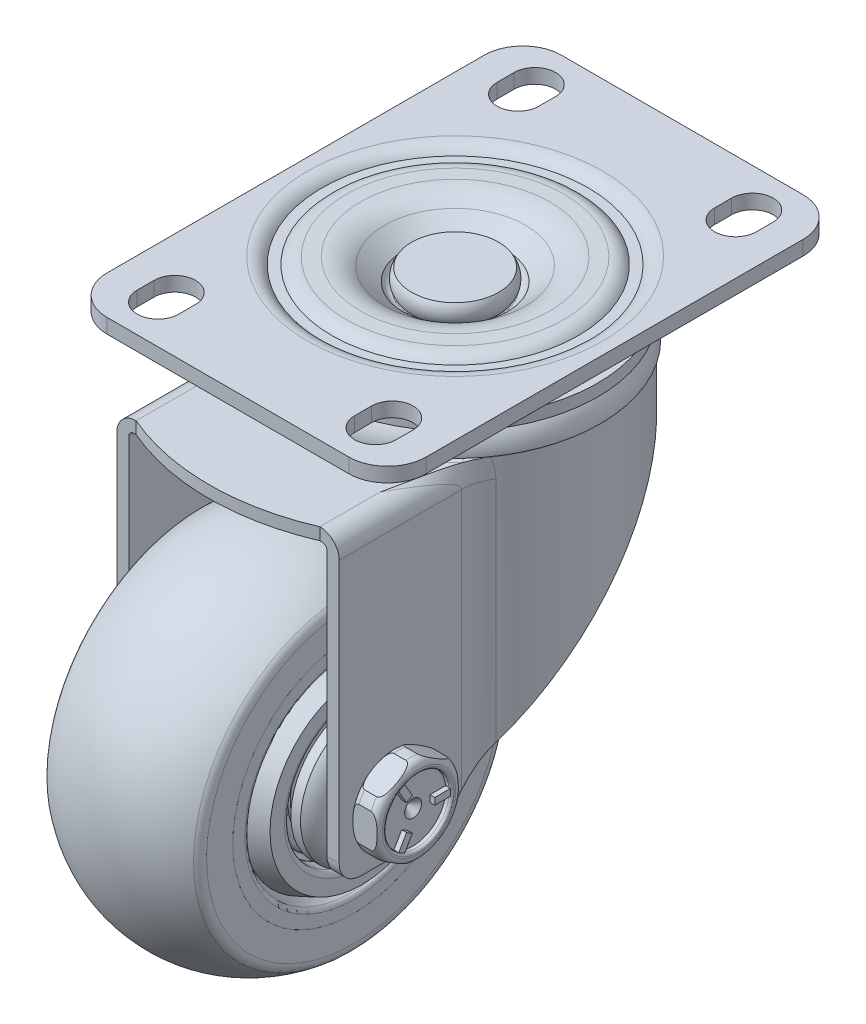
SolidWorks part; units mm, degrees
ref_plane "前视基准面" through (0, 0, 0) normal (0, 0, 1) x (1, 0, 0)
ref_plane "上视基准面" through (0, 0, 0) normal (0, 1, 0) x (1, 0, 0)
ref_plane "右视基准面" through (0, 0, 0) normal (1, 0, 0) x (0, 0, -1)
imported_body "3寸半孤平边外包_默认-1-solid1"
imported_body "轴承6001_默认-1-solid1"
imported_body "轴承6001_默认-1-solid2"
imported_body "轴承6001_默认-1-solid3"
imported_body "轴承6001_默认-1-solid4"
imported_body "轴承6001_默认-1-solid5"
imported_body "轴承6001_默认-1-solid6"
imported_body "轴承6001_默认-1-solid7"
imported_body "轴承6001_默认-1-solid8"
imported_body "轴承6001_默认-1-solid9"
imported_body "轴承6001_默认-1-solid10"
imported_body "M10螺母-1-solid1"
imported_body "3寸双轴内芯_默认-1-solid1"
imported_body "40.2mm中型中管_默认-1-solid1"
imported_body "BF30款6mm钢球_默认-1-solid1"
imported_body "BF30款6mm钢球_默认-1-solid2"
imported_body "BF30款6mm钢球_默认-1-solid3"
imported_body "BF30款6mm钢球_默认-1-solid4"
imported_body "BF30款6mm钢球_默认-1-solid5"
imported_body "BF30款6mm钢球_默认-1-solid6"
imported_body "BF30款6mm钢球_默认-1-solid7"
imported_body "BF30款6mm钢球_默认-1-solid8"
imported_body "BF30款6mm钢球_默认-1-solid9"
imported_body "BF30款6mm钢球_默认-1-solid10"
imported_body "BF30款6mm钢球_默认-1-solid11"
imported_body "BF30款6mm钢球_默认-1-solid12"
imported_body "BF30款6mm钢球_默认-1-solid13"
imported_body "BF30款6mm钢球_默认-1-solid14"
imported_body "BF30款6mm钢球_默认-1-solid15"
imported_body "BF30款6mm钢球_默认-1-solid16"
imported_body "BF30款6mm钢球_默认-1-solid17"
imported_body "BF30款6mm钢球_默认-1-solid18"
imported_body "BF30款6mm钢球_默认-1-solid19"
imported_body "BF30款6mm钢球_默认-1-solid20"
imported_body "BF30款6mm钢球_默认-1-solid21"
imported_body "轴承6001_默认-2-solid1"
imported_body "轴承6001_默认-2-solid2"
imported_body "轴承6001_默认-2-solid3"
imported_body "轴承6001_默认-2-solid4"
imported_body "轴承6001_默认-2-solid5"
imported_body "轴承6001_默认-2-solid6"
imported_body "轴承6001_默认-2-solid7"
imported_body "轴承6001_默认-2-solid8"
imported_body "轴承6001_默认-2-solid9"
imported_body "轴承6001_默认-2-solid10"
imported_body "BF30款小波碗_默认-1-solid1"
imported_body "BF30款12×19平头钉_默认-1-solid1"
imported_body "BF30款大波碗_默认-1-solid1"
imported_body "BF30款底板_默认-1-solid1"
imported_body "双轴盖仔_默认-1-solid1"
imported_body "3寸活动支架_默认-1-solid1"
imported_body "BF30款5mm钢球_默认-1-solid1"
imported_body "BF30款5mm钢球_默认-1-solid2"
imported_body "BF30款5mm钢球_默认-1-solid3"
imported_body "BF30款5mm钢球_默认-1-solid4"
imported_body "BF30款5mm钢球_默认-1-solid5"
imported_body "BF30款5mm钢球_默认-1-solid6"
imported_body "BF30款5mm钢球_默认-1-solid7"
imported_body "BF30款5mm钢球_默认-1-solid8"
imported_body "BF30款5mm钢球_默认-1-solid9"
imported_body "BF30款5mm钢球_默认-1-solid10"
imported_body "BF30款5mm钢球_默认-1-solid11"
imported_body "BF30款5mm钢球_默认-1-solid12"
imported_body "BF30款5mm钢球_默认-1-solid13"
imported_body "BF30款5mm钢球_默认-1-solid14"
imported_body "BF30款5mm钢球_默认-1-solid15"
imported_body "BF30款5mm钢球_默认-1-solid16"
imported_body "BF30款5mm钢球_默认-1-solid17"
imported_body "BF30款5mm钢球_默认-1-solid18"
imported_body "BF30款5mm钢球_默认-1-solid19"
imported_body "BF30款5mm钢球_默认-1-solid20"
imported_body "BF30款5mm钢球_默认-1-solid21"
imported_body "BF30款5mm钢球_默认-1-solid22"
imported_body "BF30款5mm钢球_默认-1-solid23"
imported_body "BF30款5mm钢球_默认-1-solid24"
imported_body "BF30款防尘圈_默认-1-solid1"
imported_body "M10-55螺杆-1-solid1"
imported_body "双轴盖仔_默认-2-solid1"
sketch "草图1" plane through (29.4528, 0, 0) normal (1, 0, 0) x (0, 0, -1)
  line L1 (-39.3183, -43.7882) -> (-28.0711, -43.7882)
  line L2 (-39.3183, -43.7882) -> (-39.3183, -67.7083)
  line L3 (-39.3183, -67.7083) -> (-28.0711, -67.7083)
  line L4 (-28.0711, -43.7882) -> (-28.0711, -67.7083)
extrude "凸台-拉伸1" add sketch "草图1" against normal blind 1
sketch "草图2" plane through (21.4462, 0, 0) normal (1, 0, 0) x (0, 0, -1)
  circle A0 centre (-36, -81.6495) radius 30.4248
  circle A1 centre (-36, -81.6495) radius 25
extrude "切除-拉伸1" cut sketch "草图2" along normal up to surface (0.35 mm away)
